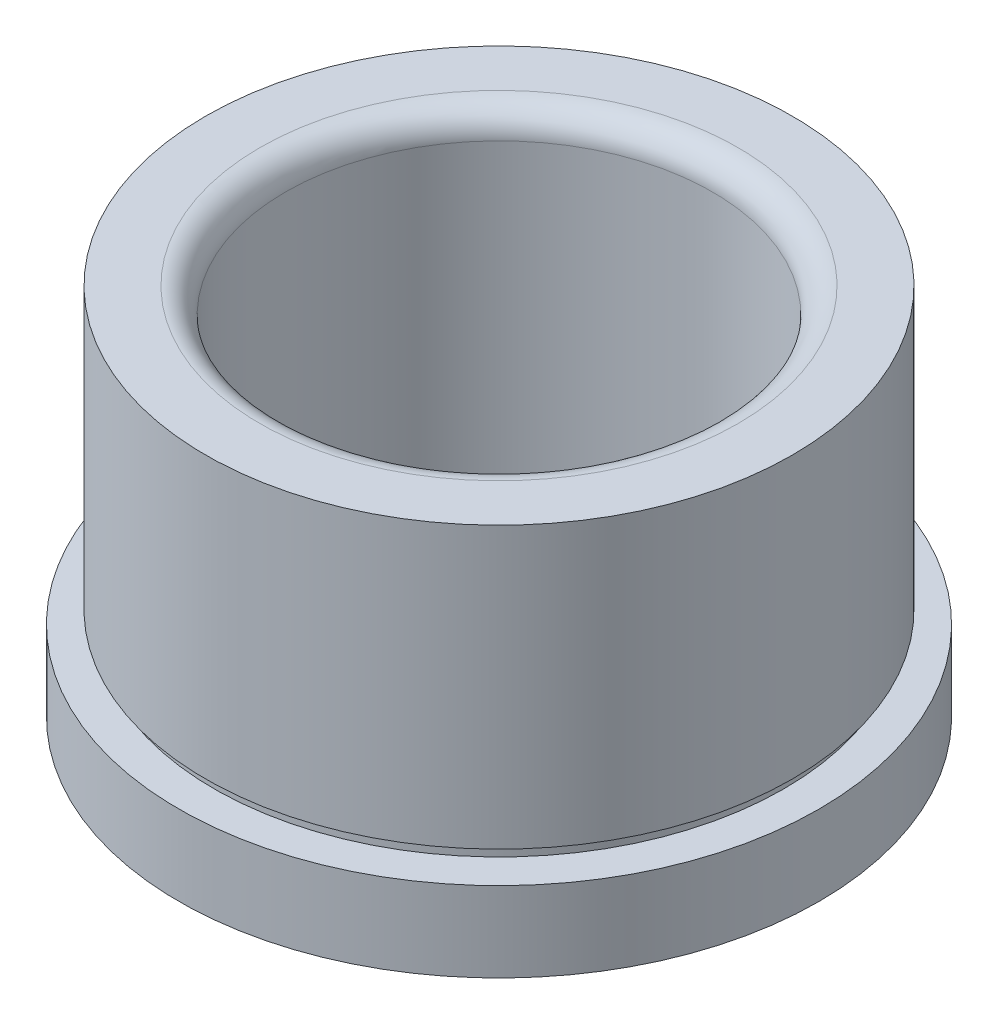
SolidWorks part; units mm, degrees
ref_plane "Front Plane" through (0, 0, 0) normal (0, 0, 1) x (1, 0, 0)
ref_plane "Top Plane" through (0, 0, 0) normal (0, 1, 0) x (1, 0, 0)
ref_plane "Right Plane" through (0, 0, 0) normal (1, 0, 0) x (0, 0, -1)
sketch "Sketch1" plane through (0, 0, 0) normal (0, 0, 1) x (1, 0, 0)
  line L0 (-765.5611, 640.0047) -> (37595.2545, -31429.4174) construction
  line L1 (0, -1000) -> (0, 49000) construction
  line L2 (-12.7063, 38.1507) -> (-12.7063, 16.7417)
  line L3 (-13.5224, 15.9257) -> (-19.05, 15.9257)
  line L4 (-19.05, 15.9257) -> (-19.05, 20.6882)
  line L5 (-19.05, 20.6882) -> (-16.9608, 20.6882)
  line L6 (-17.4688, 38.1507) -> (-17.4688, 21.4502)
  line L7 (-17.4688, 38.1507) -> (-12.7063, 38.1507)
  line L8 (-13.5224, 15.9257) -> (-12.7063, 16.7417)
  line L10 (-17.4688, 21.4502) -> (-16.9608, 21.4502)
  line L11 (-16.9608, 21.4502) -> (-16.9608, 20.6882)
  dimension "D1" = 0.508
  dimension "OD" = 34.9377
  dimension "ID" = 25.4127
  dimension "FLANGETHICKNESS" = 4.7625
  dimension "FLANGEDIA" = 38.1
  dimension "D2" = 45
  dimension "D3" = 0.762
  dimension "OVERALL LENGTH" = 22.225
revolve "Revolve1" add sketch "Sketch1" angle 360 about L1
fillet "Fillet1" radius 1.524 1 edges at (12.7063, 38.1507, 0)
